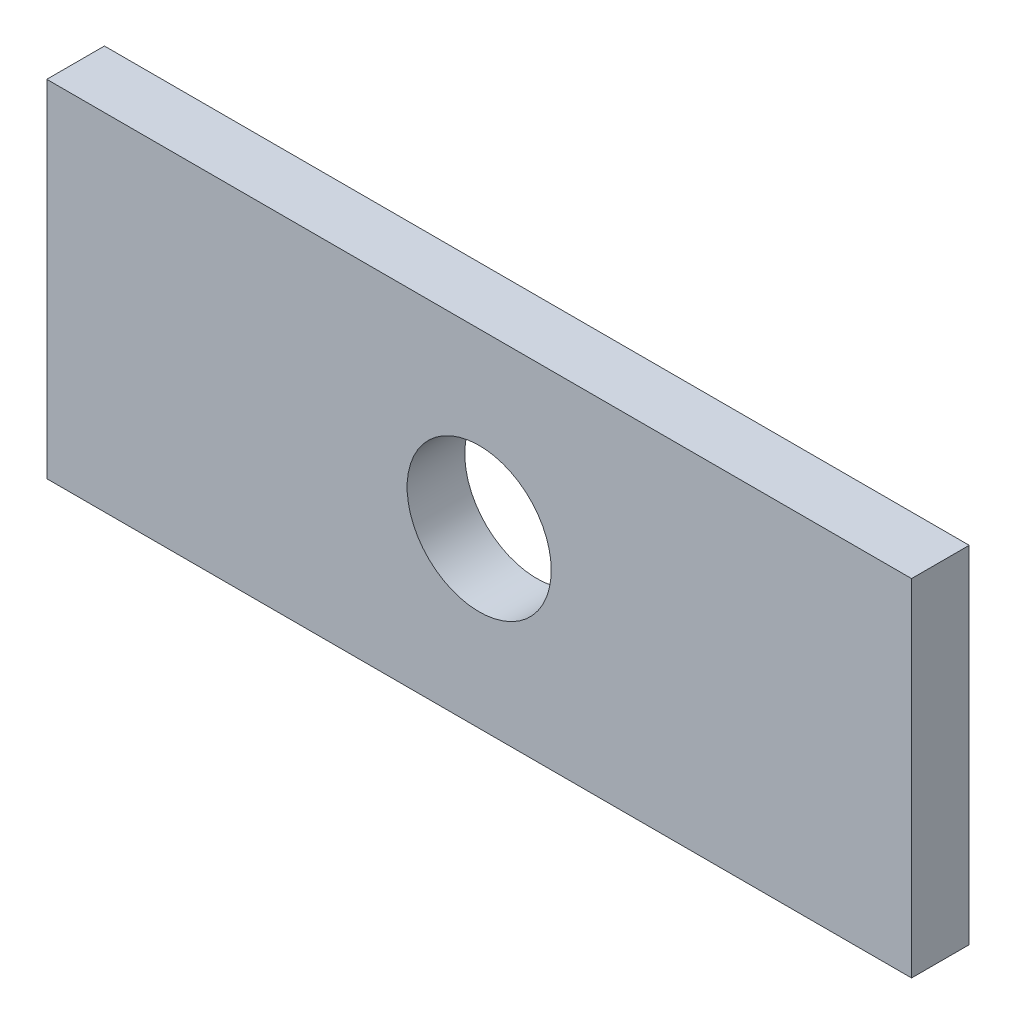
SolidWorks part; units mm, degrees
ref_plane "Front" through (0, 0, 0) normal (0, 0, 1) x (1, 0, 0)
ref_plane "Top" through (0, 0, 0) normal (0, 1, 0) x (1, 0, 0)
ref_plane "Right" through (0, 0, 0) normal (1, 0, 0) x (0, 0, -1)
sketch "Esquisse1" plane through (0, 0, 0) normal (0, 0, 1) x (1, 0, 0)
  line L1 (-75, -30) -> (75, -30)
  line L2 (-75, -30) -> (-75, 30)
  line L3 (-75, 30) -> (75, 30)
  line L4 (75, -30) -> (75, 30)
  line L5 (-75, -30) -> (75, 30) construction
  line L6 (-75, 30) -> (75, -30) construction
  point P0 (0, 0)
  dimension "D1" = 60
  dimension "D2" = 150
extrude "Boss.-Extru.1" add sketch "Esquisse1" along normal blind 10 contours L2 L3 L4 L1
sketch "Esquisse2" plane through (0, 0, 10) normal (0, 0, 1) x (1, 0, 0)
  circle A0 centre (0, 0) radius 12.5
  dimension "D1" = 25
extrude "Enlèv. mat.-Extru.1" cut sketch "Esquisse2" against normal blind 10
sketch "Esquisse3" [suppressed] plane through (0, 0, 10) normal (0, 0, 1) x (1, 0, 0)
  line L1 (10, -10) -> (-10, -10)
  line L2 (10, -10) -> (10, 10)
  line L3 (10, 10) -> (-10, 10)
  line L4 (-10, -10) -> (-10, 10)
  line L5 (10, -10) -> (-10, 10) construction
  line L6 (10, 10) -> (-10, -10) construction
  point P0 (0, 0)
  dimension "D1" = 20
extrude "Enlèv. mat.-Extru.2" [suppressed] cut sketch "Esquisse3" against normal blind 10
